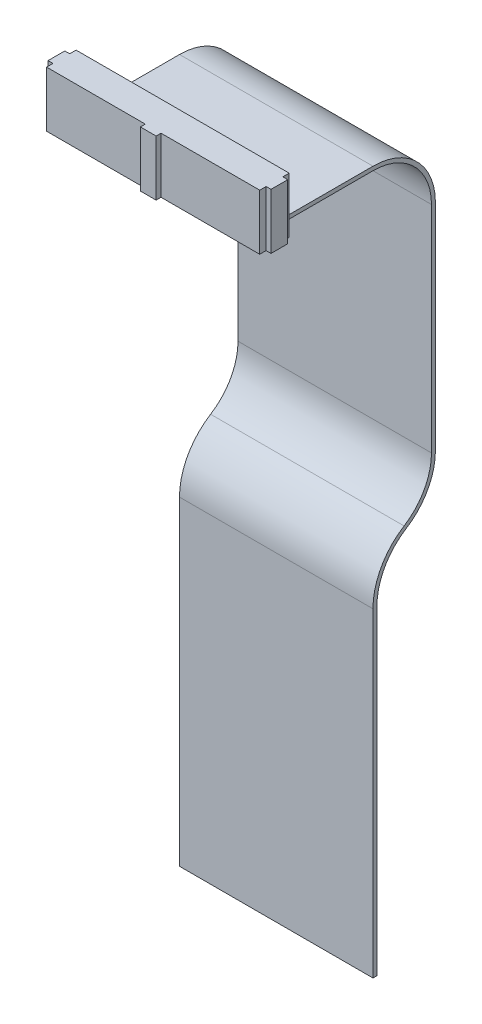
SolidWorks part; units mm, degrees
ref_plane "Front" through (0, 0, 0) normal (0, 0, 1) x (1, 0, 0)
ref_plane "Top" through (0, 0, 0) normal (0, 1, 0) x (1, 0, 0)
ref_plane "Right" through (0, 0, 0) normal (1, 0, 0) x (0, 0, -1)
sketch "Sketch1" plane through (0, 0, 0) normal (0, 1, 0) x (1, 0, 0)
  line L0 (20.9299, 3) -> (-22.685, 3) construction
  line L1 (-21.685, 6) -> (21.685, 6)
  line L2 (-21.685, 6) -> (-21.685, 4.7)
  line L3 (-21.685, 0) -> (-1.6, 0)
  line L4 (21.685, 6) -> (21.685, 4.7)
  line L5 (-22.685, 4.7) -> (-21.685, 4.7)
  line L6 (-22.685, 4.7) -> (-22.685, 1.3)
  line L7 (-22.685, 1.3) -> (-21.685, 1.3)
  line L8 (-21.685, 1.3) -> (-21.685, 0)
  line L9 (1.6, 0) -> (21.685, 0)
  line L10 (-1.6, 0) -> (-1.6, -1)
  line L11 (-1.6, -1) -> (1.6, -1)
  line L12 (1.6, 0) -> (1.6, -1)
  line L13 (21.685, 4.7) -> (22.685, 4.7)
  line L14 (21.685, 1.3) -> (21.685, 0)
  line L15 (21.685, 1.3) -> (22.685, 1.3)
  line L16 (22.685, 4.7) -> (22.685, 1.3)
  line L17 (0, 6) -> (0, -1) construction
  dimension "D1" = 6
  dimension "D2" = 43.37
  dimension "D3" = 1
  dimension "D4" = 1
  dimension "D5" = 3.4
  dimension "D6" = 3
  dimension "D7" = 1
  dimension "D8" = 3.2
extrude "Extrude1" add sketch "Sketch1" along normal blind 11.3
sketch "Sketch2" plane through (0, 0, 0) normal (1, 0, 0) x (0, 0, -1)
  line L0 (6, 11.3) -> (6, 0) construction
  line L1 (6, 2) -> (9, 2)
  line L2 (6, 2) -> (6, 1.2)
  line L3 (6, 1.2) -> (9, 1.2)
  line L4 (9, 2) -> (9, 1.2)
  line L5 (4.7, 11.3) -> (6, 11.3) construction
  dimension "D1" = 9.3
  dimension "D2" = 0.8
  dimension "D3" = 3
extrude "Extrude2" add sketch "Sketch2" along normal mid plane 39.37
sketch "Sketch3" plane through (0, 0, -9) normal (0, 0, -1) x (-1, 0, 0)
  line L0 (-19.685, 2) -> (19.685, 2) construction
  point P0 (0, 2)
sketch "Sketch5" plane through (0, 0, -9) normal (0, 0, -1) x (-1, 0, 0)
  line L4 (19.685, 1.2) -> (19.685, 2)
  line L5 (19.685, 2) -> (-19.685, 2)
  line L6 (-19.685, 2) -> (-19.685, 1.2)
  line L7 (-19.685, 1.2) -> (19.685, 1.2)
  line L8 (19.685, 1.2) -> (19.685, 2)
  line L9 (19.685, 2) -> (-19.685, 2)
  line L10 (-19.685, 2) -> (-19.685, 1.2)
  line L11 (-19.685, 1.2) -> (19.685, 1.2)
  dimension "D1" = 0
sketch "Sketch6" plane through (0, 0, 0) normal (1, 0, 0) x (0, 0, -1)
  line L0 (9, 2) -> (25.05, 2)
  line L1 (37.75, -10.7) -> (37.75, -54.4807)
  line L3 (25.8438, -76) -> (25.8438, -141.0655)
  line L4 (1.3, 0) -> (4.7, 0) construction
  line L7 (6, 11.3) -> (6, 0) construction
  arc A0 (25.05, 2) -> (37.75, -10.7) centre (25.05, -10.7) cw
  arc A1 (37.75, -54.4807) -> (31.7969, -65.2404) centre (25.05, -54.4807) cw
  arc A2 (31.7969, -65.2404) -> (25.8438, -76) centre (38.5438, -76) ccw
  dimension "D1" = 12.7
  dimension "D2" = 31.75
  dimension "D3" = 19.8438
  dimension "D5" = 76
sweep "Sweep2" add profiles "Sketch5" path "Sketch6"
